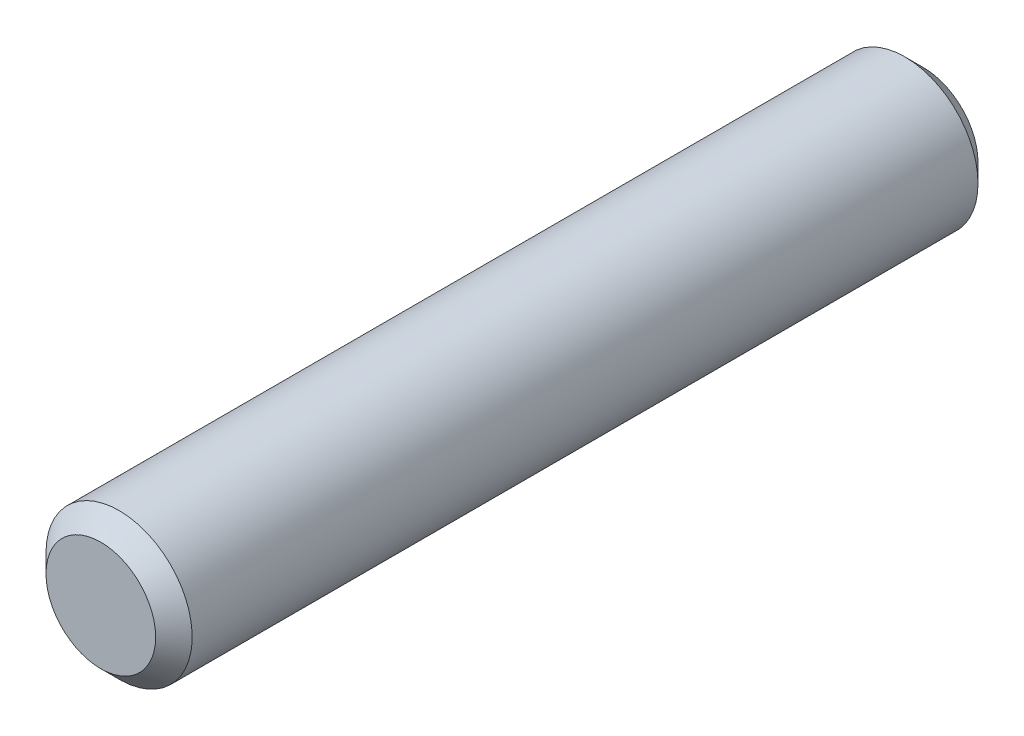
SolidWorks part; units mm, degrees
ref_plane "Plan de face" through (0, 0, 0) normal (0, 0, 1) x (1, 0, 0)
ref_plane "Plan de dessus" through (0, 0, 0) normal (0, 1, 0) x (1, 0, 0)
ref_plane "Plan de droite" through (0, 0, 0) normal (1, 0, 0) x (0, 0, -1)
sketch "Esquisse1" plane through (0, 0, 0) normal (0, 0, 1) x (1, 0, 0)
  circle A0 centre (0, 0) radius 4
  dimension "D1" = 8
extrude "Boss.-Extru.1" add sketch "Esquisse1" along normal blind 45
chamfer "Chanfrein1" distance 1 angle 45 2 edges at (4, 0, 0) (4, 0, 45)
